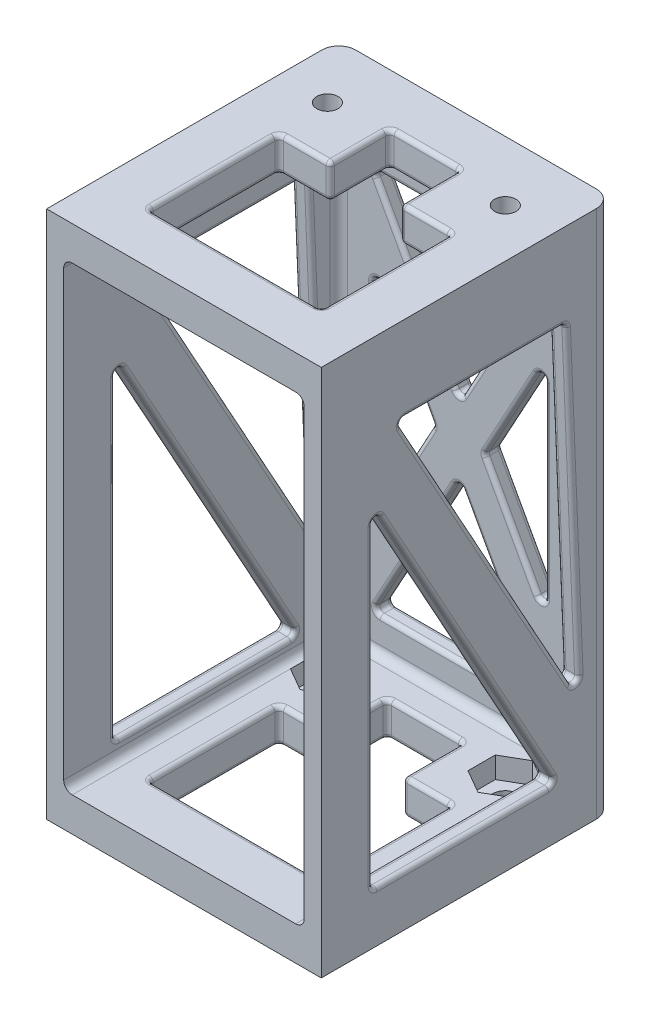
SolidWorks part; units mm, degrees
ref_plane "Front Plane" through (0, 0, 0) normal (0, 0, 1) x (1, 0, 0)
ref_plane "Top Plane" through (0, 0, 0) normal (0, 1, 0) x (1, 0, 0)
ref_plane "Right Plane" through (0, 0, 0) normal (1, 0, 0) x (0, 0, -1)
sketch "Sketch1" plane through (0, 0, 0) normal (0, 1, 0) x (1, 0, 0)
  line L1 (0, 0) -> (32.2, 0)
  line L2 (0, 0) -> (0, 34.25)
  line L3 (0, 34.25) -> (32.2, 34.25)
  line L4 (32.2, 0) -> (32.2, 34.25)
  dimension "D1" = 34.25
  dimension "D2" = 32.2
extrude "Boss-Extrude1" add sketch "Sketch1" along normal blind 4
sketch "Sketch2" plane through (0, 4, 0) normal (0, 1, 0) x (1, 0, 0)
  line L0 (32.2, 34.25) -> (0, 34.25) construction
  line L3 (16.1, 27.25) -> (5.67, 27.25) construction
  line L4 (16.1, 27.25) -> (26.53, 27.25) construction
  line L5 (16.1, 34.25) -> (16.1, 0) construction
  line L6 (0, 0) -> (32.2, 0) construction
  dimension "D1" = 10.43
  dimension "D2" = 7
ref_plane "Plane1" through (0, 58, 0) normal (0, 1, 0) x (1, 0, 0)
sketch "Sketch5" plane through (0, 58, 0) normal (0, 1, 0) x (1, 0, 0)
  line L1 (0, 34.25) -> (32.2, 34.25)
  line L2 (0, 34.25) -> (0, 0)
  line L3 (0, 0) -> (32.2, 0)
  line L4 (32.2, 34.25) -> (32.2, 0)
  dimension "D1" = 34.25
extrude "Boss-Extrude2" add sketch "Sketch5" along normal blind 4 separate body
sketch "Sketch6" plane through (0, 62, 0) normal (0, 1, 0) x (1, 0, 0)
  line L0 (16.1, 34.25) -> (16.1, 0) construction
  line L1 (32.2, 34.25) -> (0, 34.25) construction
  line L2 (0, 0) -> (32.2, 0) construction
  line L3 (16.1, 27.25) -> (5.67, 27.25) construction
  line L4 (16.1, 27.25) -> (26.53, 27.25) construction
  dimension "D1" = 10.43
  dimension "D2" = 7
sketch "Sketch11" plane through (0, 0, 0) normal (-1, 0, 0) x (0, 0, 1)
  line L0 (-34.25, 4) -> (-34.25, 58)
  line L1 (-34.25, 58) -> (0, 58)
  line L2 (0, 58) -> (0, 4)
  line L3 (0, 4) -> (-34.25, 4)
  line L4 (-34.25, 31) -> (0, 31) construction
extrude "Boss-Extrude3" add sketch "Sketch11" against normal blind 2
sketch "Sketch13" plane through (0, 0, 0) normal (-1, 0, 0) x (0, 0, 1)
  line L0 (-28.6924, 52) -> (-8.9515, 52)
  line L1 (-6, 44.9345) -> (-6, 6)
  line L2 (-6, 6) -> (-27.5082, 6)
  line L5 (-34.25, 62) -> (0, 62) construction
  line L6 (0, 62) -> (0, 0) construction
  line L7 (-34.25, 0) -> (0, 0) construction
  line L8 (17.71, 58) -> (-17.71, 58) construction
  line L9 (-30.2821, 13.3869) -> (-8.9515, 52)
  line L10 (-6, 44.9345) -> (-27.5082, 6)
  line L11 (0, 62) -> (-34.25, 0) construction
  line L12 (-30.2821, 13.3869) -> (-28.6924, 52)
  dimension "D1" = 6
  dimension "D2" = 6
  dimension "D4" = 6
  dimension "D5" = 3
  dimension "D6" = 3
extrude "Cut-Extrude1" cut sketch "Sketch13" against normal up to next
pattern_linear "LPattern1" count 2 spacing 30.2 along (1, 0, 0) of "Boss-Extrude3", "Cut-Extrude1"
sketch "Sketch16" plane through (0, 62, 0) normal (0, 1, 0) x (1, 0, 0)
  line L0 (12, 21.25) -> (6, 21.25)
  line L1 (26.2, 6) -> (6, 6)
  line L2 (26.2, 6) -> (26.2, 21.25)
  line L3 (26.2, 21.25) -> (20.2, 21.25)
  line L4 (6, 6) -> (6, 21.25)
  line L6 (20.2, 21.25) -> (20.2, 28.25)
  line L7 (20.2, 28.25) -> (12, 28.25)
  line L8 (12, 21.25) -> (12, 28.25)
  line L9 (32.2, 0) -> (32.2, 34.25) construction
  line L10 (0, 0) -> (32.2, 0) construction
  line L11 (0, 34.25) -> (0, 0) construction
  line L13 (32.2, 34.25) -> (0, 34.25) construction
  dimension "D1" = 6
  dimension "D2" = 6
  dimension "D3" = 6
  dimension "D4" = 6
  dimension "D5" = 6
  dimension "D6" = 6
  dimension "D7" = 6
  dimension "D8" = 6
extrude "Cut-Extrude3" cut sketch "Sketch16" against normal up to next
sketch "Sketch17" plane through (0, 0, 0) normal (0, -1, 0) x (1, 0, 0)
  line L0 (11.67, -21.25) -> (6, -21.25)
  line L1 (26.2, -6) -> (6, -6)
  line L2 (26.2, -6) -> (26.2, -21.25)
  line L3 (26.2, -21.25) -> (20.53, -21.25)
  line L4 (6, -6) -> (6, -21.25)
  line L6 (11.67, -21.25) -> (11.67, -28.25)
  line L7 (11.67, -28.25) -> (20.53, -28.25)
  line L8 (20.53, -21.25) -> (20.53, -28.25)
  line L9 (0, 0) -> (32.2, 0) construction
  line L10 (32.2, 0) -> (32.2, -34.25) construction
  line L11 (0, -34.25) -> (0, 0) construction
  line L12 (32.2, -34.25) -> (0, -34.25) construction
  dimension "D1" = 6
  dimension "D2" = 6
  dimension "D3" = 6
  dimension "D4" = 6
  dimension "D5" = 6
  dimension "D6" = 6
  dimension "D7" = 6
extrude "Cut-Extrude4" cut sketch "Sketch17" against normal up to next
sketch "Sketch18" plane through (2, 0, 0) normal (1, 0, 0) x (0, 0, -1)
  line L0 (34.25, 4) -> (32.25, 4)
  line L1 (34.25, 4) -> (0, 4) construction
  line L2 (32.25, 4) -> (32.25, 58)
  line L3 (0, 58) -> (34.25, 58) construction
  line L4 (32.25, 58) -> (34.25, 58)
  line L5 (34.25, 58) -> (34.25, 4)
  dimension "D1" = 2
extrude "Boss-Extrude5" add sketch "Sketch18" along normal up to next
sketch "Sketch19" plane through (0, 0, -34.25) normal (0, 0, -1) x (-1, 0, 0)
  line L0 (-16.1, 54.8836) -> (-16.1, 0.6881) construction
  line L3 (-32.2, 30.4346) -> (0, 30.4346) construction
  line L4 (-32.2, 62) -> (-32.2, 0) construction
  line L5 (0, 62) -> (0, 0) construction
  line L6 (-26.2, 52.8692) -> (-6, 52.8692)
  line L7 (-16.1, 52.8692) -> (-16.1, 34.4346) construction
  line L8 (-16.1, 34.4346) -> (-26.2, 52.8692)
  line L9 (-32.2, 62) -> (0, 62) construction
  line L10 (-16.1, 34.4346) -> (-6, 52.8692)
  line L11 (-16.1, 26.4346) -> (-26.2, 8)
  line L12 (-26.2, 8) -> (-6, 8)
  line L13 (-16.1, 26.4346) -> (-6, 8)
  line L14 (-6, 43.3984) -> (-6, 17.4708)
  line L15 (-6, 43.3984) -> (-13.1026, 30.4346)
  line L16 (-6, 17.4708) -> (-13.1026, 30.4346)
  line L17 (-26.2, 43.3984) -> (-19.0974, 30.4346)
  line L18 (-26.2, 17.4708) -> (-19.0974, 30.4346)
  line L19 (-26.2, 43.3984) -> (-26.2, 17.4708)
  line L21 (-30.2, 4) -> (-2, 4) construction
  line L22 (0, 62) -> (0, 0) construction
  line L23 (-32.2, 0) -> (0, 0) construction
  point P24 (-16.1, 27.7858)
  point P26 (-6, 30.4346)
  dimension "D1" = 6
  dimension "D2" = 9.1308
  dimension "D3" = 6
  dimension "D4" = 4
  dimension "D5" = 4
  dimension "D6" = 4
  dimension "D7" = 0.6881
  dimension "D8" = 7.1164
  dimension "D9" = 16.1
extrude "Cut-Extrude5" cut sketch "Sketch19" against normal up to next
fillet "Fillet9" radius 0.5 120 edges at (26.2, 62, -13.625) (26.2, 58, -13.625) (6, 58, -13.625) (6, 62, -13.625) (12, 58, -24.75) (12, 62, -24.75) (20.2, 62, -24.75) (20.2, 58, -24.75) (26.2, 4, -13.625) (26.2, 0, -13.625) (16.1, 4, -28.25) (16.1, 0, -28.25) (6, 0, -13.625) (6, 4, -13.625) (2, 6, -16.7541) (0, 6, -16.7541) (0, 25.4672, -6) (2, 25.4672, -6) (2, 52, -18.822) (0, 52, -18.822) (0, 32.6935, -29.4873) (2, 32.6935, -29.4873) (32.2, 6, -16.7541) (30.2, 6, -16.7541) (30.2, 25.4672, -6) (32.2, 25.4672, -6) (32.2, 52, -18.822) (30.2, 52, -18.822) (30.2, 32.6935, -29.4873) (32.2, 32.6935, -29.4873) (22.6487, 23.9527, -32.25) (22.6487, 23.9527, -34.25) (22.6487, 36.9165, -34.25) (22.6487, 36.9165, -32.25) (9.5513, 36.9165, -32.25) (9.5513, 36.9165, -34.25) (9.5513, 23.9527, -34.25) (9.5513, 23.9527, -32.25) (21.15, 43.6519, -32.25) (21.15, 43.6519, -34.25) (11.05, 43.6519, -34.25) (11.05, 43.6519, -32.25) (11.05, 17.2173, -32.25) (11.05, 17.2173, -34.25) (21.15, 17.2173, -34.25) (21.15, 17.2173, -32.25) (26.2, 60, -6) (16.1, 62, -6) (6, 60, -6) (16.1, 58, -6) (20.2, 60, -21.25) (23.2, 62, -21.25) (26.2, 60, -21.25) (23.2, 58, -21.25) (6, 60, -21.25) (9, 62, -21.25) (12, 60, -21.25) (9, 58, -21.25) (12, 60, -28.25) (16.1, 62, -28.25) (20.2, 60, -28.25) (16.1, 58, -28.25) (6, 2, -6) (16.1, 0, -6) (26.2, 2, -6) (16.1, 4, -6) (26.2, 2, -21.25) (23.365, 0, -21.25) (23.365, 4, -21.25) (20.53, 2, -21.25) (20.53, 0, -24.75) (20.53, 2, -28.25) (20.53, 4, -24.75) (11.67, 2, -28.25) (11.67, 0, -24.75) (11.67, 4, -24.75) (11.67, 2, -21.25) (8.835, 0, -21.25) (6, 2, -21.25) (8.835, 4, -21.25) (1, 6, -27.5082) (0, 25.4672, -16.7541) (1, 44.9345, -6) (2, 25.4672, -16.7541) (1, 52, -8.9515) (0, 32.6935, -19.6168) (1, 13.3869, -30.2821) (2, 32.6935, -19.6168) (31.2, 6, -27.5082) (30.2, 25.4672, -16.7541) (31.2, 44.9345, -6) (32.2, 25.4672, -16.7541) (31.2, 52, -8.9515) (30.2, 32.6935, -19.6168) (31.2, 13.3869, -30.2821) (32.2, 32.6935, -19.6168) (26.2, 17.4708, -33.25) (26.2, 30.4346, -34.25) (26.2, 43.3984, -33.25) (26.2, 30.4346, -32.25) (6, 43.3984, -33.25) (6, 30.4346, -34.25) (6, 17.4708, -33.25) (6, 30.4346, -32.25) (26.2, 52.8692, -33.25) (16.1, 52.8692, -34.25) (6, 52.8692, -33.25) (16.1, 52.8692, -32.25) (6, 8, -33.25) (16.1, 8, -34.25) (26.2, 8, -33.25) (16.1, 8, -32.25) (1, 6, -6) (1, 52, -28.6924) (31.2, 6, -6) (31.2, 52, -28.6924) (19.0974, 30.4346, -33.25) (13.1026, 30.4346, -33.25) (16.1, 26.4346, -33.25) (16.1, 34.4346, -33.25)
fillet "Fillet10" radius 1 8 edges at (30.2, 58, -16.125) (2, 58, -16.125) (16.1, 58, -32.25) (30.2, 4, -16.125) (30.2, 31, -32.25) (2, 31, -32.25) (2, 4, -16.125) (16.1, 4, -32.25)
fillet "Fillet11" radius 2 2 edges at (32.2, 31, -34.25) (0, 31, -34.25)
sketch "Sketch20" plane through (0, 4, 0) normal (0, 1, 0) x (1, 0, 0)
  circle A0 centre (5.67, 27.25) radius 1.5
  circle A1 centre (26.53, 27.25) radius 1.5
  dimension "D1" = 3
extrude "Cut-Extrude6" cut sketch "Sketch20" against normal blind 10
sketch "Sketch21" plane through (0, 62, 0) normal (0, 1, 0) x (1, 0, 0)
  circle A0 centre (5.67, 27.25) radius 1.25
  circle A1 centre (26.53, 27.25) radius 1.25
  dimension "D1" = 2.5
extrude "Cut-Extrude7" cut sketch "Sketch21" against normal up to next
sketch "Sketch22" plane through (0, 4, 0) normal (0, 1, 0) x (1, 0, 0)
  line L0 (11.17, 21.75) -> (11.17, 27.75) construction
  line L1 (8.445, 25.6479) -> (8.445, 28.8521)
  line L2 (8.445, 28.8521) -> (5.67, 30.4543)
  line L3 (5.67, 30.4543) -> (2.895, 28.8521)
  line L4 (2.895, 28.8521) -> (2.895, 25.6479)
  line L5 (2.895, 25.6479) -> (5.67, 24.0457)
  line L6 (5.67, 24.0457) -> (8.445, 25.6479)
  line L7 (23.755, 25.6479) -> (26.53, 24.0457)
  line L8 (26.53, 24.0457) -> (29.305, 25.6479)
  line L9 (29.305, 25.6479) -> (29.305, 28.8521)
  line L10 (29.305, 28.8521) -> (26.53, 30.4543)
  line L11 (26.53, 30.4543) -> (23.755, 28.8521)
  line L12 (23.755, 28.8521) -> (23.755, 25.6479)
  line L13 (21.03, 27.75) -> (21.03, 21.75) construction
  circle A0 centre (5.67, 27.25) radius 2.775 construction
  circle A1 centre (26.53, 27.25) radius 2.775 construction
  dimension "D1" = 5.55
extrude "Cut-Extrude8" cut sketch "Sketch22" against normal blind 2.5
sketch "Sketch23" plane through (0, 0, -34.25) normal (0, 0, -1) x (-1, 0, 0)
  line L0 (-16.1, 0) -> (-16.1, 7.5) construction
  line L1 (-30.2, 0) -> (-2, 0) construction
  line L2 (-6.8441, 7.5) -> (-25.3559, 7.5) construction
